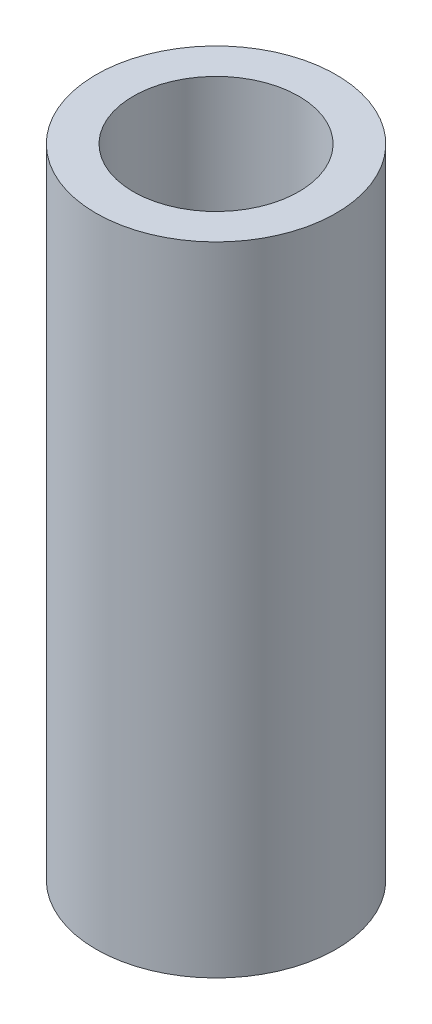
SolidWorks part; units mm, degrees
ref_plane "Aufriss" through (0, 0, 0) normal (0, 0, 1) x (1, 0, 0)
ref_plane "Grundriss" through (0, 0, 0) normal (0, 1, 0) x (1, 0, 0)
ref_plane "Seitenriss" through (0, 0, 0) normal (1, 0, 0) x (0, 0, -1)
sketch "Skizze1" plane through (0, 0, 0) normal (0, 1, 0) x (1, 0, 0)
  circle A0 centre (0, 0) radius 7.25
  circle A1 centre (0, 0) radius 5
  dimension "D1" = 14.5
  dimension "D2" = 10
extrude "Aufsatz-Linear austragen1" add sketch "Skizze1" along normal mid plane 38.5
